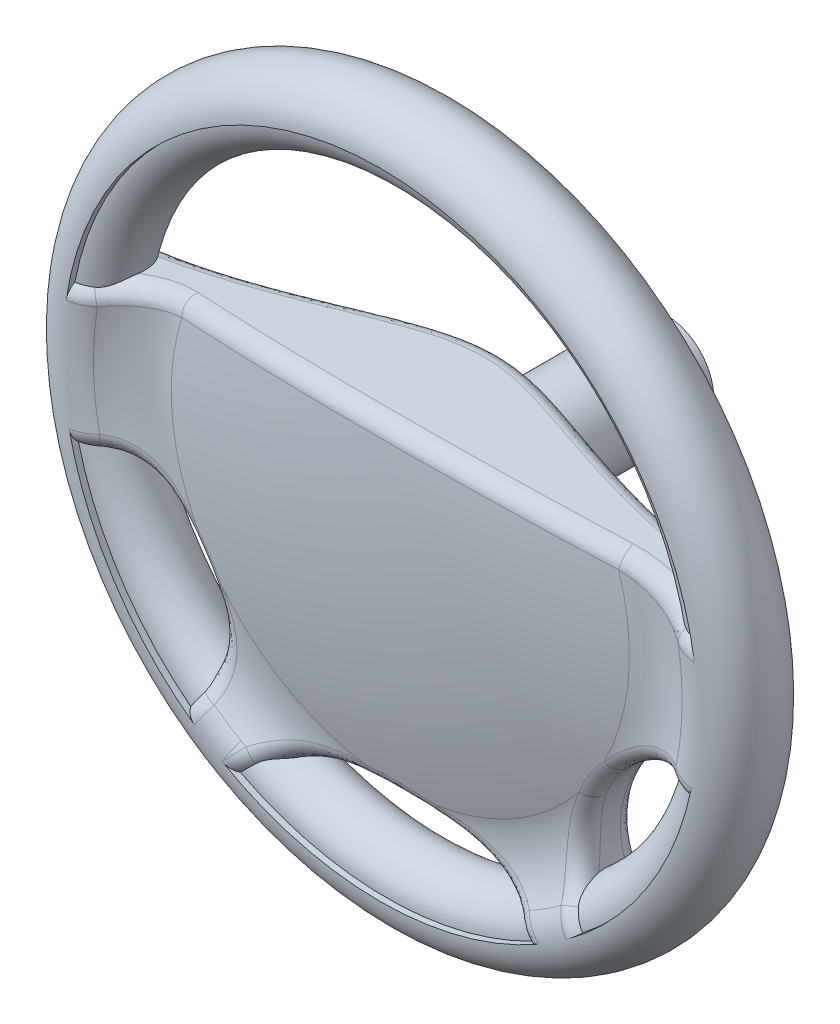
SolidWorks part; units mm, degrees
ref_plane "正面" through (0, 0, 0) normal (0, 0, 1) x (1, 0, 0)
ref_plane "平面" through (0, 0, 0) normal (0, 1, 0) x (1, 0, 0)
ref_plane "右側面" through (0, 0, 0) normal (1, 0, 0) x (0, 0, -1)
sketch "ｽｹｯﾁ1" plane through (0, 0, 0) normal (0, 0, 1) x (1, 0, 0)
  circle A0 centre (0, 0) radius 22.5
  dimension "D1" = 45
surface "ｻｰﾌｪｽ-押し出し1" sketch "ｽｹｯﾁ1" parameters "D1"=7
surface "ｻｰﾌｪｽ-平面1"
surface "ｻｰﾌｪｽ-編みあわせ1"
other "ハンドル製作領域"
sketch "ｽｹｯﾁ3" plane through (0, 0, -3.5) normal (0, 0, -1) x (-1, 0, 0)
  circle A0 centre (0, 0) radius 5
  dimension "D1" = 10
extrude "押し出し1" add sketch "ｽｹｯﾁ3" along normal blind 2
sketch "ｽｹｯﾁ4" plane through (0, 0, -5.5) normal (0, 0, -1) x (-1, 0, 0)
  circle A0 centre (0, 0) radius 3
  dimension "D1" = 6
extrude "押し出し2" add sketch "ｽｹｯﾁ4" along normal blind 10
sketch "ハンドル径" plane through (0, 0, 0) normal (1, 0, 0) x (0, 0, -1)
  line L0 (15.5, 0) -> (-3.5, 0) construction
  line L1 (-3.5, -22.5) -> (3.5, -22.5) construction
  line L2 (3.5, 22.5) -> (-3.5, 22.5) construction
  line L4 (15.5, -3) -> (15.5, 3) construction
  line L6 (-3.5, 22.5) -> (-3.5, -22.5) construction
  line L7 (0, 0) -> (0, 20) construction
  line L9 (3.5, 22.5) -> (-3.5, 22.5)
  line L10 (-3.5, -22.5) -> (3.5, -22.5)
  circle A0 centre (0, 20) radius 2.5
  point P8 (21.2787, 10.8021)
  dimension "D1" = 5
sketch "ｽｹｯﾁ7" plane through (0, 0, 0) normal (1, 0, 0) x (0, 0, -1)
  line L0 (15.5, 0) -> (-3.5, 0) construction
  line L1 (5.5, -5) -> (5.5, 5) construction
  line L2 (5.5, 5) -> (5.5, 0)
  line L3 (5.5, 0) -> (-3, 0)
  line L4 (-3, 0) -> (-3, 10.6763) construction
  line L5 (-4.6266, 0) -> (18.5817, 0) construction
  line L6 (0, 0) -> (0, 20) construction
  circle A0 centre (0, 20) radius 2.5 construction
  arc A1 (2.4616, 19.5637) -> (-2.0312, 18.5425) centre (0, 20) ccw
  arc A2 (-2.0312, 18.5425) -> (-1.2401, 14.4253) centre (-6.0935, 15.6274) cw
  arc A3 (-1.2401, 14.4253) -> (-3, 0) centre (57, 0) ccw
  arc A4 (2.4616, 19.5637) -> (5.5, 5) centre (22.1547, 16.0734) ccw
  dimension "D2" = 60
  dimension "D3" = 5
  dimension "D4" = 20
  dimension "D1" = 3
revolve "回転1" add sketch "ｽｹｯﾁ7" angle 360 about L5
sketch "カットレイアウト" plane through (0, 0, 0) normal (0, 0, 1) x (1, 0, 0)
  line L0 (0, 25.283) -> (0, -26.1548) construction
  line L1 (-26.7542, 0) -> (29.5876, 0) construction
  arc A1 (-19.5959, 4) -> (19.5959, 4) centre (0, -73.5629) cw
  circle A3 centre (0, 0) radius 20
  arc A5 (-19.3649, -5) -> (-12.5, -15.6125) centre (-18.46, -11.9413) cw
  arc A6 (19.3649, -5) -> (12.5, -15.6125) centre (18.46, -11.9413) ccw
  arc A7 (-9, -17.8606) -> (9, -17.8606) centre (0, -29.8606) cw
  circle A8 centre (0, 0) radius 22.5 construction
  dimension "D1" = 2.5
  dimension "D6" = 80
  dimension "D7" = 7
  dimension "D8" = 15
  dimension "D2" = 18
  dimension "D3" = 25
  dimension "D4" = 5
  dimension "D5" = 4
sketch "ｽｹｯﾁ11" plane through (0, 0, 0) normal (0, 0, 1) x (1, 0, 0)
  arc A0 (19.3649, -5) -> (12.5, -15.6125) centre (18.46, -11.9413) ccw construction
  arc A1 (-12.5, -15.6125) -> (-19.3649, -5) centre (-18.46, -11.9413) ccw construction
  arc A2 (19.5959, 4) -> (-19.5959, 4) centre (0, -73.5629) ccw construction
  arc A3 (9, -17.8606) -> (-9, -17.8606) centre (0, -29.8606) ccw construction
  arc A4 (19.3649, -5) -> (12.5, -15.6125) centre (18.46, -11.9413) ccw
  arc A5 (-12.5, -15.6125) -> (-19.3649, -5) centre (-18.46, -11.9413) ccw
  arc A6 (19.5959, 4) -> (-19.5959, 4) centre (0, -73.5629) ccw
  arc A7 (9, -17.8606) -> (-9, -17.8606) centre (0, -29.8606) ccw
  arc A8 (-19.3649, -5) -> (-12.5, -15.6125) centre (0, 0) ccw
  circle A9 centre (0, 0) radius 20
  arc A10 (19.5959, 4) -> (-19.5959, 4) centre (0, 0) ccw
  arc A11 (-9, -17.8606) -> (9, -17.8606) centre (0, 0) ccw
  arc A12 (12.5, -15.6125) -> (19.3649, -5) centre (0, 0) ccw
  dimension "D1" = 0
extrude "押し出し3" cut sketch "ｽｹｯﾁ11" against normal through all and the other way through all
fillet "ﾌｨﾚｯﾄ1" radius 1 27 edges at (-12.2857, -15.2393, 2.4636) (-18.5328, -4.9416, 2.3618) (-18.4153, 4.2888, 2.249) (18.6178, 4.2406, 2.3303) (18.9367, -4.9575, 2.4636) (12.1056, -14.8775, 2.3618) (8.6894, -17.6338, 2.4766) (0, -5, -5.5) (13.231, -7.2875, -2.1782) (0.4259, 6.436, -4.6221) (-12.0715, -9.08, -2.1782) (-0.0191, -14.8606, -2.1915) (-3.5433, 6.3586, 2.5568) (-13.3652, -7.141, 1.116) (16.2135, 4.7769, 1.2588) (-15.9901, 4.8228, 1.2102) (11.9929, -9.2624, 1.116) (2.1075, -15.0094, 1.1157)
sketch "ｽｹｯﾁ12" plane through (0, 0, 0) normal (1, 0, 0) x (0, 0, -1)
  line L0 (-10.4889, 0) -> (19.6567, 0) construction
  circle A2 centre (0, 20) radius 2.1
  circle A3 centre (0, 20) radius 2.1
  dimension "D1" = 0.4
revolve "回転2" add sketch "ｽｹｯﾁ12" angle 360 about L0
